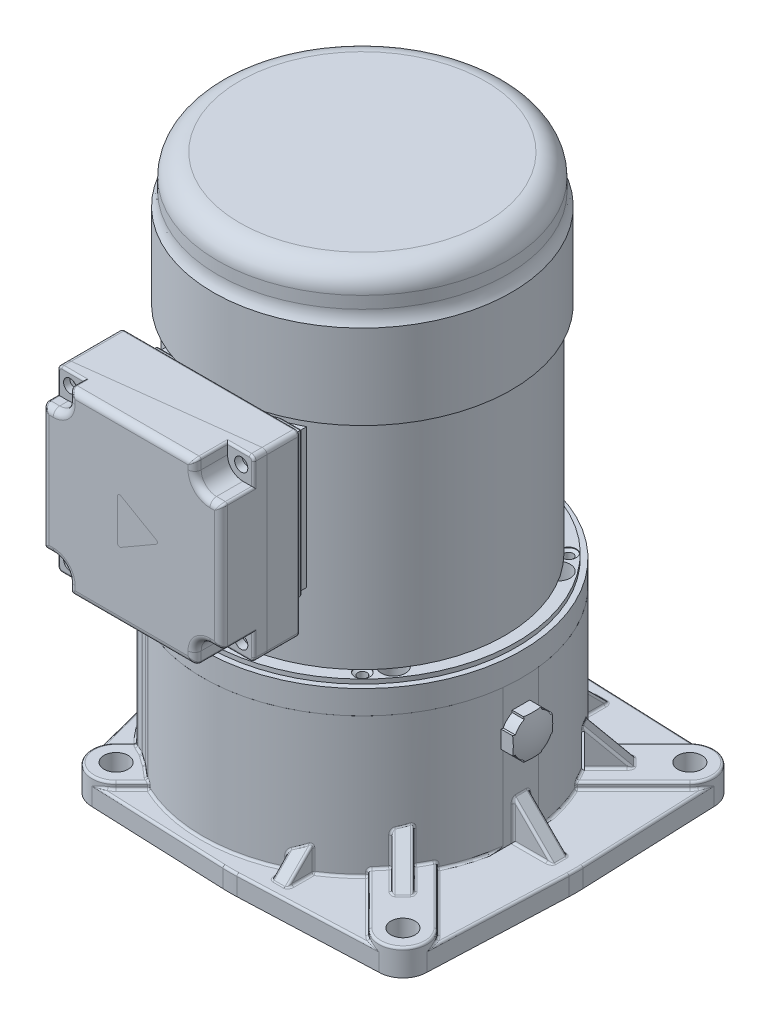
SolidWorks part; units mm, degrees
ref_plane "前视基准面" through (0, 0, 0) normal (0, 0, 1) x (1, 0, 0)
ref_plane "上视基准面" through (0, 0, 0) normal (0, 1, 0) x (1, 0, 0)
ref_plane "右视基准面" through (0, 0, 0) normal (1, 0, 0) x (0, 0, -1)
imported_body "接线盒座-1-surface1"
imported_body "接线盒座-1-surface2"
imported_body "接线盒座-1-surface3"
imported_body "接线盒座-1-surface4"
imported_body "接线盒座-1-surface5"
imported_body "接线盒座-1-surface6"
imported_body "接线盒座-1-surface7"
imported_body "接线盒盖-1-surface1"
imported_body "接线盒盖-1-surface2"
imported_body "接线盒盖-1-surface3"
imported_body "接线盒盖-1-surface4"
imported_body "立式箱体装配.SLDPRT-1/15.11.08 22箱盖B-1-surface1"
imported_body "立式箱体装配.SLDPRT-1/15.05.20 22立式B-1-surface1"
imported_body "立式箱体装配.SLDPRT-1/3轴22-1-surface1"
imported_body "立式箱体装配.SLDPRT-1/3轴22-1-surface2"
imported_body "立式箱体装配.SLDPRT-1/GB／T13871．1-2007唇形密封圈B型B1525X40X7-1-surface1"
imported_body "立式箱体装配.SLDPRT-1/透气塞-1-surface1"
imported_body "立式箱体装配.SLDPRT-1/7X32-1-surface1"
sketch "草图1" plane through (0, -115.1427, 0) normal (0, 1, 0) x (1, 0, 0)
  circle A0 centre (335.5053, 88.1377) radius 65
extrude "凸台-拉伸1" add sketch "草图1" along normal blind 98.5
sketch "草图2" plane through (0, -16.6427, 0) normal (0, 1, 0) x (1, 0, 0)
  circle A0 centre (335.5053, 88.1377) radius 68
extrude "凸台-拉伸2" add sketch "草图2" along normal blind 38.5
sketch "草图3" plane through (0, 21.8573, 0) normal (0, 1, 0) x (1, 0, 0)
  circle A0 centre (335.5053, 88.1377) radius 66
extrude "凸台-拉伸3" add sketch "草图3" along normal blind 21.5
fillet "圆角1" radius 10 2 edges at (335.5053, 43.3573, -22.1377) (335.5053, 21.8573, -22.1377)
